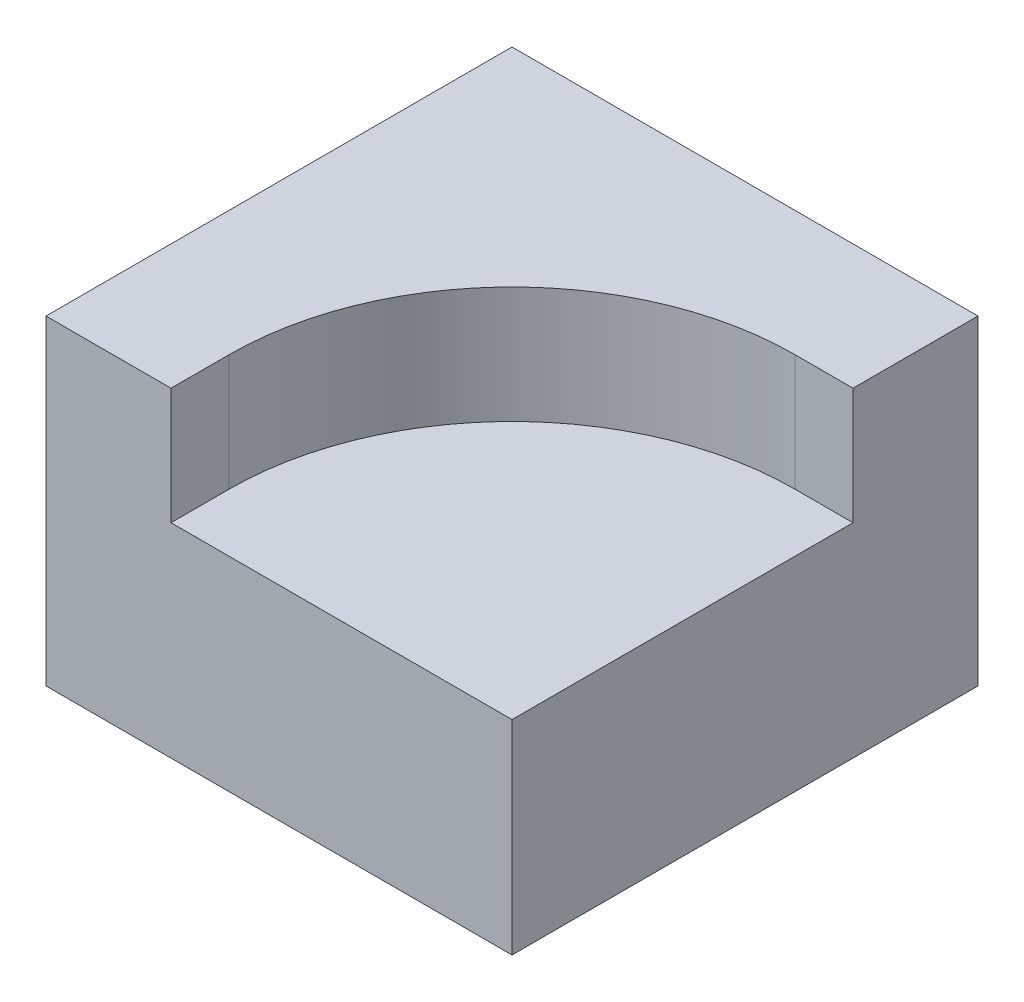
SolidWorks part; units mm, degrees
ref_plane "Front Plane" through (0, 0, 0) normal (0, 0, 1) x (1, 0, 0)
ref_plane "Top Plane" through (0, 0, 0) normal (0, 1, 0) x (1, 0, 0)
ref_plane "Right Plane" through (0, 0, 0) normal (1, 0, 0) x (0, 0, -1)
sketch "Sketch1" plane through (0, 0, 0) normal (0, 1, 0) x (1, 0, 0)
  line L1 (0, 0) -> (101.6, 0)
  line L2 (0, 0) -> (0, 101.6)
  line L3 (0, 101.6) -> (101.6, 101.6)
  line L4 (101.6, 0) -> (101.6, 101.6)
  dimension "D1" = 101.6
  dimension "D2" = 101.6
extrude "Extrude1" add sketch "Sketch1" along normal blind 69.85
sketch "Sketch2" plane through (0, 69.85, 0) normal (0, 1, 0) x (-1, 0, 0)
  line L0 (-101.6, -74.3521) -> (-88.9053, -74.3521)
  line L1 (-101.6, 0) -> (-101.6, -101.6) construction
  line L2 (-27.2532, -12.7) -> (-27.2532, 0)
  line L3 (0, 0) -> (-101.6, 0) construction
  line L4 (-101.6, -74.3521) -> (-101.6, 0)
  line L5 (-101.6, 0) -> (-27.2532, 0)
  arc A0 (-88.9053, -74.3521) -> (-27.2532, -12.7) centre (-88.9053, -12.7) ccw
  dimension "D1" = 12.7
extrude "Cut-Extrude1" cut sketch "Sketch2" against normal blind 25.4
